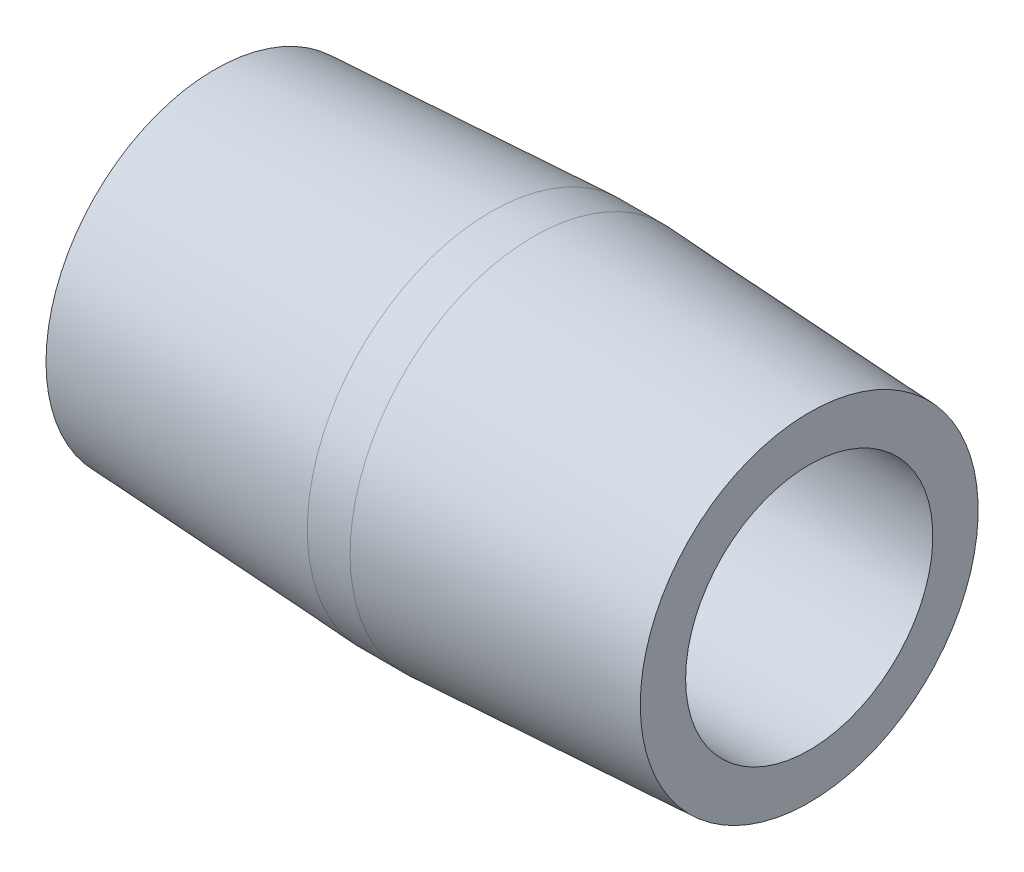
SolidWorks part; units mm, degrees
ref_plane "Front Plane" through (0, 0, 0) normal (0, 0, 1) x (1, 0, 0)
ref_plane "Top Plane" through (0, 0, 0) normal (0, 1, 0) x (1, 0, 0)
ref_plane "Right Plane" through (0, 0, 0) normal (1, 0, 0) x (0, 0, -1)
sketch "Sketch1" plane through (0, 0, 0) normal (0, 1, 0) x (1, 0, 0)
  line L6 (22.225, 4.6228) -> (0, 4.6228)
  line L7 (10.3124, 6.858) -> (0, 6.3175)
  line L8 (0, 6.3175) -> (0, 4.6228)
  line L9 (11.9126, 6.858) -> (10.3124, 6.858)
  line L10 (22.225, 6.3175) -> (11.9126, 6.858)
  line L11 (22.225, 4.6228) -> (22.225, 6.3175)
  line L12 (-6.376, 0) -> (49993.624, 0) construction
  dimension "D1" = 9.2456
  dimension "D2" = 13.716
  dimension "D3" = 3
  dimension "D4" = 3
  dimension "D5" = 22.225
  dimension "D6" = 10.3124
  dimension "D7" = 10.3124
revolve "Revolve1" add sketch "Sketch1" angle 360 about L12
